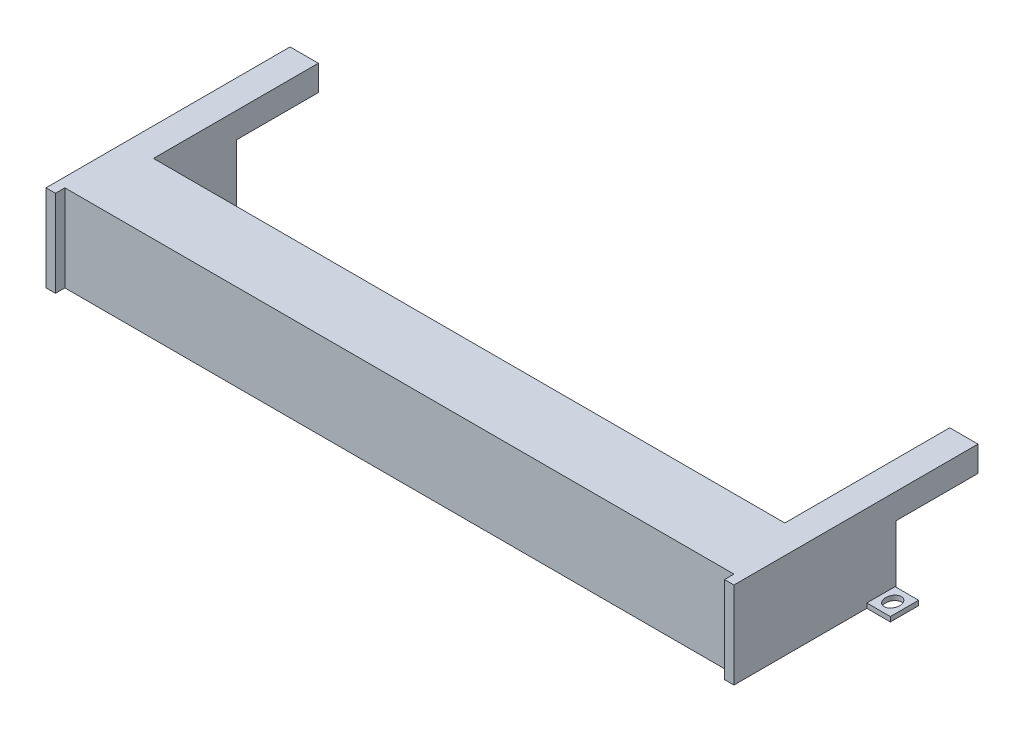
SolidWorks part; units mm, degrees
ref_plane "Front Plane" through (0, 0, 0) normal (0, 0, 1) x (1, 0, 0)
ref_plane "Top Plane" through (0, 0, 0) normal (0, 1, 0) x (1, 0, 0)
ref_plane "Right Plane" through (0, 0, 0) normal (1, 0, 0) x (0, 0, -1)
sketch "Sketch1" plane through (0, 0, 0) normal (0, 1, 0) x (1, 0, 0)
  line L1 (-36.5, 12.95) -> (36.5, 12.95)
  line L2 (-36.5, 12.95) -> (-36.5, -12.95)
  line L3 (-36.5, -12.95) -> (36.5, -12.95)
  line L4 (36.5, 12.95) -> (36.5, -12.95)
  line L5 (-36.5, 12.95) -> (36.5, -12.95) construction
  line L6 (-36.5, -12.95) -> (36.5, 12.95) construction
  point P0 (0, 0)
  dimension "D1" = 25.9
  dimension "D2" = 73
extrude "Boss-Extrude1" add sketch "Sketch1" along normal blind 9.2
sketch "Sketch2" plane through (36.5, 0, 0) normal (1, 0, 0) x (0, 0, -1)
  line L0 (-12.95, 9.2) -> (-12.95, 0) construction
  line L1 (12.95, 0) -> (4.25, 0)
  line L2 (12.95, 0) -> (12.95, 6.5)
  line L3 (12.95, 6.5) -> (4.25, 6.5)
  line L4 (4.25, 0) -> (4.25, 6.5)
  dimension "D1" = 6.5
  dimension "D2" = 17.2
extrude "Cut-Extrude1" cut sketch "Sketch2" against normal up to next
sketch "Sketch3" plane through (0, 9.2, 0) normal (0, 1, 0) x (1, 0, 0)
  line L0 (-36.5, -12.95) -> (36.5, -12.95) construction
  line L1 (-35.5, -16.9168) -> (35.5, -16.9168)
  line L2 (-35.5, -16.9168) -> (-35.5, -11.95)
  line L3 (-35.5, -11.95) -> (35.5, -11.95)
  line L4 (35.5, -16.9168) -> (35.5, -11.95)
  line L5 (-36.5, 12.95) -> (-36.5, -12.95) construction
  line L6 (36.5, -12.95) -> (36.5, 12.95) construction
  dimension "D1" = 1
  dimension "D2" = 1
  dimension "D3" = 1
extrude "Cut-Extrude2" cut sketch "Sketch3" against normal up to next
sketch "Sketch5" plane through (0, 0, 0) normal (0, -1, 0) x (1, 0, 0)
  line L1 (36.5, 12.95) -> (36.5, -4.25) construction
  line L2 (39, -1.15) -> (36.5, -1.15)
  line L3 (39, -1.15) -> (39, -4.15)
  line L4 (39, -4.15) -> (36.5, -4.15)
  line L5 (36.5, -1.15) -> (36.5, -4.15)
  line L6 (39, -1.15) -> (36.5, -4.15) construction
  line L7 (39, -4.15) -> (36.5, -1.15) construction
  ellipse E0 centre (37.75, -2.65) end of major axis (37.75, -3.5747) minor radius 0.7425
  point P0 (37.75, -2.65)
  dimension "D1" = 15.6
  dimension "D2" = 39
  dimension "D3" = 3
extrude "Boss-Extrude2" add sketch "Sketch5" against normal blind 0.5
sketch "Sketch6" plane through (0, 9.2, 0) normal (0, 1, 0) x (1, 0, 0)
  line L0 (36.5, 12.95) -> (-36.5, 12.95) construction
  line L1 (-33.5, 12.95) -> (33.5, 12.95)
  line L2 (-33.5, 12.95) -> (-33.5, -4.55)
  line L3 (-33.5, -4.55) -> (33.5, -4.55)
  line L4 (33.5, 12.95) -> (33.5, -4.55)
  line L5 (0, 0) -> (0, 15.6008) construction
  dimension "D1" = 17.5
  dimension "D2" = 67
extrude "Cut-Extrude3" cut sketch "Sketch6" against normal through all
mirror "Mirror1" about plane through (0, 0, 0) normal (1, 0, 0) of "Boss-Extrude2"
